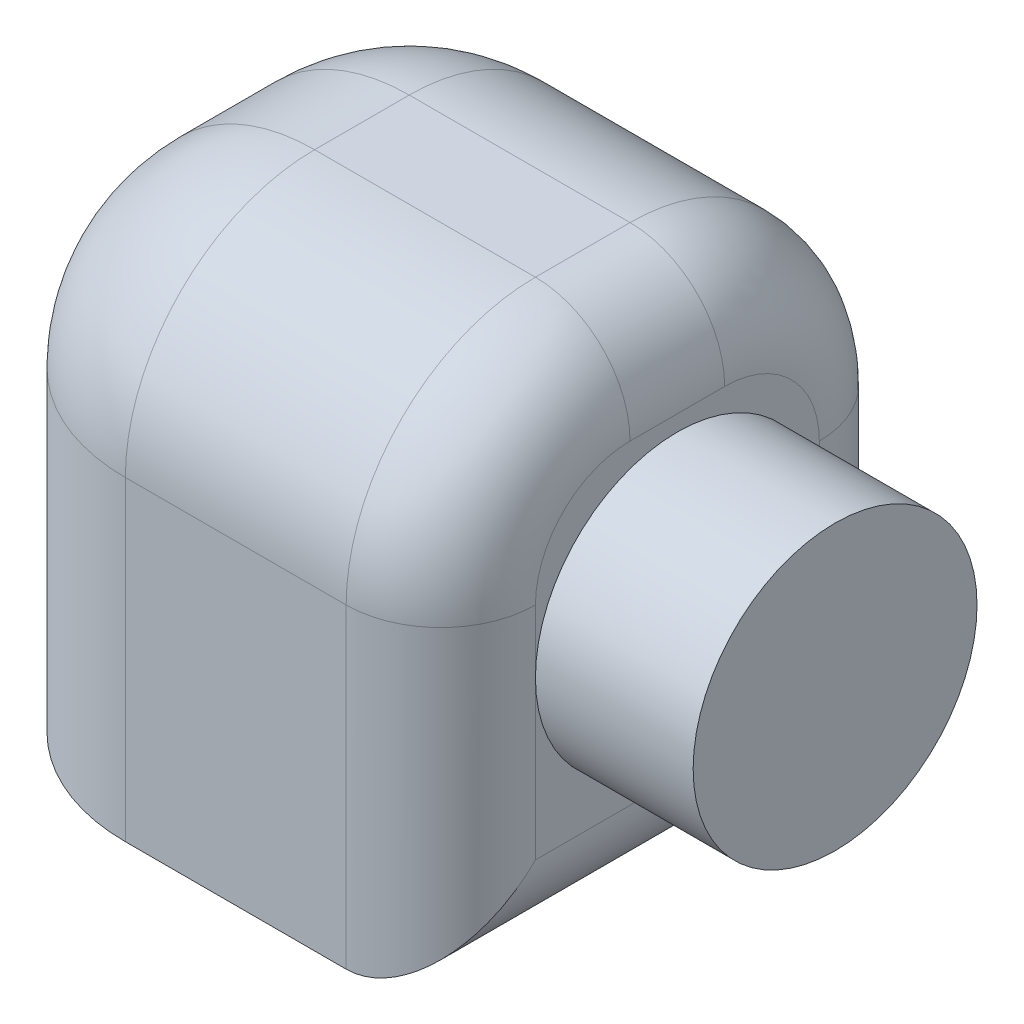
SolidWorks part; units mm, degrees
ref_plane "Plan de face" through (0, 0, 0) normal (0, 0, 1) x (1, 0, 0)
ref_plane "Plan de dessus" through (0, 0, 0) normal (0, 1, 0) x (1, 0, 0)
ref_plane "Plan de droite" through (0, 0, 0) normal (1, 0, 0) x (0, 0, -1)
sketch "Esquisse1" plane through (0, 0, 0) normal (0, 1, 0) x (1, 0, 0)
  line L1 (0, 0) -> (160, 0)
  line L2 (0, 0) -> (0, 150)
  line L3 (0, 150) -> (160, 150)
  line L4 (160, 0) -> (160, 150)
  dimension "D1" = 160
  dimension "D2" = 150
extrude "Boss.-Extru.1" add sketch "Esquisse1" along normal blind 160
sketch "Esquisse2" plane through (160, 0, 0) normal (1, 0, 0) x (0, 0, -1)
  line L0 (75, 160) -> (75, 0) construction
  line L1 (0, 160) -> (150, 160) construction
  line L2 (0, 0) -> (150, 0) construction
  circle A0 centre (75, 80) radius 45
extrude "Boss.-Extru.2" add sketch "Esquisse2" along normal blind 50 contours A0
sketch "Esquisse3" plane through (0, 0, 0) normal (0, -1, 0) x (1, 0, 0)
  line L0 (80, 0) -> (80, -150) construction
  line L1 (0, 0) -> (160, 0) construction
  line L2 (160, -150) -> (0, -150) construction
  circle A0 centre (80, -75) radius 45
extrude "Enlèv. mat.-Extru.1" cut sketch "Esquisse3" against normal blind 50
fillet "Congé1" radius 60 5 edges at (0, 160, -75) (80, 160, -150) (0, 80, -150) (80, 160, 0) (0, 80, 0)
fillet "Congé2" radius 30 1 edges at (160, 0, -75)
fillet "Congé3" radius 30 5 edges at (160, 65, 0) (160, 160, -75) (160, 142.4264, -17.5736) (160, 142.4264, -132.4264) (160, 65, -150)
